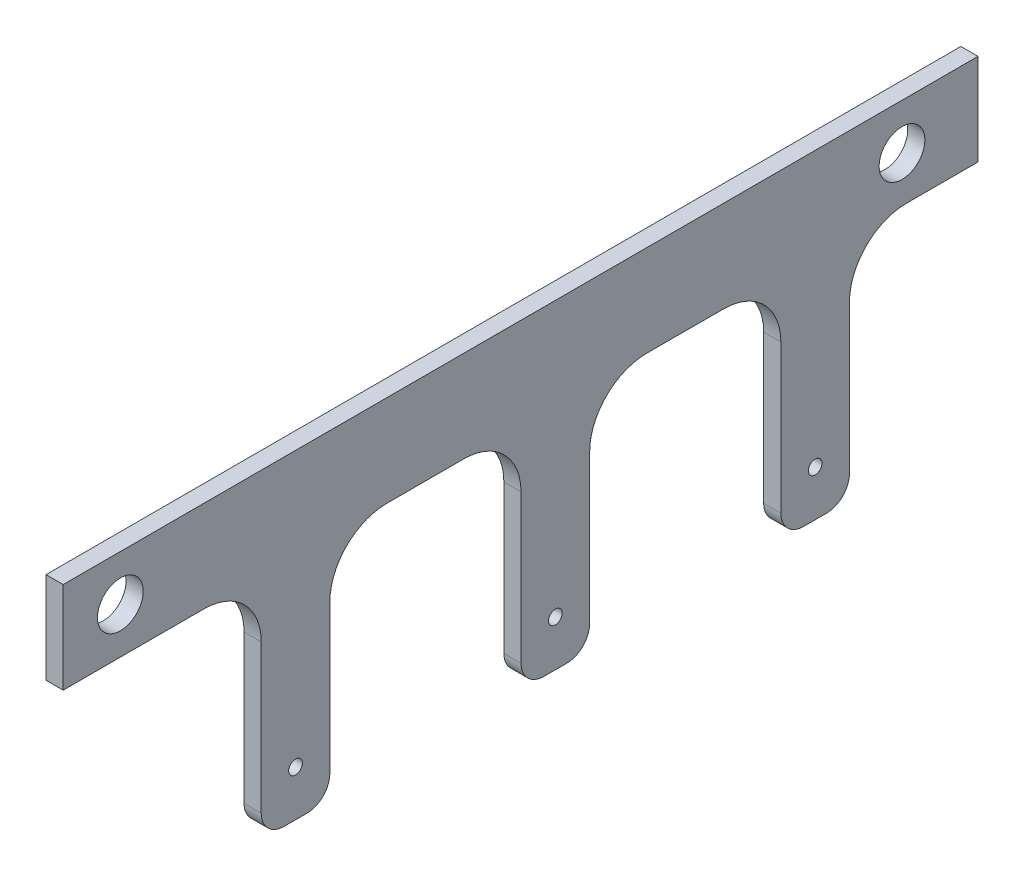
SolidWorks part; units mm, degrees
ref_plane "Front Plane" through (0, 0, 0) normal (0, 0, 1) x (1, 0, 0)
ref_plane "Top Plane" through (0, 0, 0) normal (0, 1, 0) x (1, 0, 0)
ref_plane "Right Plane" through (0, 0, 0) normal (1, 0, 0) x (0, 0, -1)
sketch "Sketch2" plane through (0, 0, 0) normal (1, 0, 0) x (0, 0, -1)
  line L0 (-128.5098, 7.056) -> (125.4902, 7.056) construction
  line L1 (-128.5098, -5.644) -> (-73.5204, -5.644)
  line L2 (-128.5098, -5.644) -> (-128.5098, 19.756)
  line L3 (-128.5098, 19.756) -> (125.4902, 19.756)
  line L4 (125.4902, -5.644) -> (125.4902, 19.756)
  line L5 (-128.5098, -5.644) -> (125.4902, 19.756) construction
  line L6 (-128.5098, 19.756) -> (125.4902, -5.644) construction
  line L7 (-73.5204, -5.644) -> (-73.5204, -69.0732)
  line L8 (-73.5204, -69.0732) -> (-54.4704, -69.0732)
  line L9 (-54.4704, -69.0732) -> (-54.4704, -5.644)
  line L10 (-1.3871, -5.644) -> (-1.3871, -69.0732)
  line L11 (-1.3871, -69.0732) -> (17.6629, -69.0732)
  line L12 (17.6629, -69.0732) -> (17.6629, -5.644)
  line L13 (70.7462, -5.644) -> (70.7462, -69.0732)
  line L14 (70.7462, -69.0732) -> (89.7962, -69.0732)
  line L15 (89.7962, -69.0732) -> (89.7962, -5.644)
  line L16 (-109.4598, -48.4484) -> (-109.4598, -71.5116) construction
  line L17 (-73.5204, -5.644) -> (-54.4704, -5.644) construction
  line L18 (-54.4704, -5.644) -> (-1.3871, -5.644)
  line L19 (-1.3871, -5.644) -> (17.6629, -5.644) construction
  line L20 (17.6629, -5.644) -> (70.7462, -5.644)
  line L21 (70.7462, -5.644) -> (89.7962, -5.644) construction
  line L22 (89.7962, -5.644) -> (125.4902, -5.644)
  line L23 (-63.9954, -69.0732) -> (-63.9954, -47.2912) construction
  circle A3 centre (-63.9954, -56.3732) radius 1.905
  circle A4 centre (8.1379, -56.3732) radius 1.905
  circle A5 centre (80.2712, -56.3732) radius 1.905
  circle A6 centre (-63.9954, -56.3732) radius 1.905 construction
  circle A7 centre (8.1379, -56.3732) radius 1.905 construction
  circle A8 centre (80.2712, -56.3732) radius 1.905 construction
  point P0 (-1.5098, 7.056)
  point P7 (-111.1355, -9.5102)
  point P26 (8.1379, -69.0732)
  point P42 (-63.9954, -56.3732)
  dimension "D1" = 254
  dimension "D2" = 19.05
  dimension "D8" = 3.81
  dimension "D3" = 25.4
  dimension "D5" = 12.7
  dimension "D6" = 62.738
  dimension "D7" = 19.05
extrude "Boss-Extrude1" add sketch "Sketch2" along normal blind 4.7625
sketch "Sketch3" plane through (4.7625, 0, 0) normal (1, 0, 0) x (0, 0, -1)
  line L0 (-128.5098, 7.056) -> (125.4902, 7.056) construction
  line L1 (-128.5098, 19.756) -> (-128.5098, -5.644) construction
  line L2 (125.4902, -5.644) -> (125.4902, 19.756) construction
  circle A0 centre (-112.6348, 7.056) radius 6.35
  dimension "D1" = 15.875
  dimension "D2" = 12.7
extrude "Cut-Extrude1" cut sketch "Sketch3" against normal through all
pattern_linear "LPattern1" count 2 spacing 217.0239 along (0, 0, -1) of "Cut-Extrude1"
fillet "Fillet1" radius 15.875 6 edges at (2.3813, -5.644, -89.7962) (2.3813, -5.644, -70.7462) (2.3813, -5.644, -17.6629) (2.3813, -5.644, 1.3871) (2.3813, -5.644, 54.4704) (2.3813, -5.644, 73.5204)
fillet "Fillet2" radius 6.35 6 edges at (2.3813, -69.0732, -89.7962) (2.3813, -69.0732, -70.7462) (2.3813, -69.0732, -17.6629) (2.3813, -69.0732, 1.3871) (2.3813, -69.0732, 54.4704) (2.3813, -69.0732, 73.5204)
equation "\"pulley_d\"= 1.1in"
equation "\"belt_len\"= 24in"
equation "\"axle_dist\"= ( \"belt_len\" - 2 * pi * \"pulley_d\" ) / 2"
equation "\"D3@LPattern1\"=\"axle_dist\""
